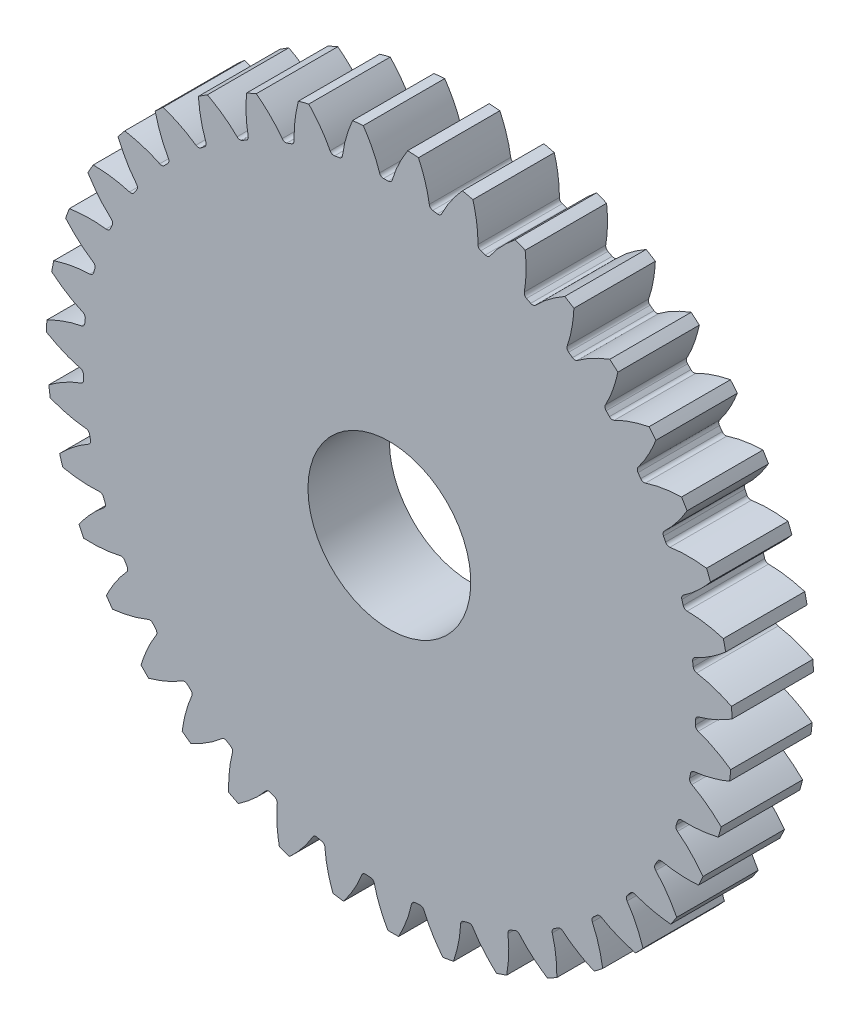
SolidWorks part; units mm, degrees
ref_plane "Face" through (0, 0, 0) normal (0, 0, 1) x (1, 0, 0)
ref_plane "Dessus" through (0, 0, 0) normal (0, 1, 0) x (1, 0, 0)
ref_plane "Droite" through (0, 0, 0) normal (1, 0, 0) x (0, 0, -1)
imported_body "Importée1"
sketch "Esquisse1" plane through (0, 0, 2.1) normal (0, 0, 1) x (1, 0, 0)
  circle A0 centre (0, 0) radius 6.106
  dimension "D1" = 12.212
surface "Surface-primitive" sketch "Esquisse1"
